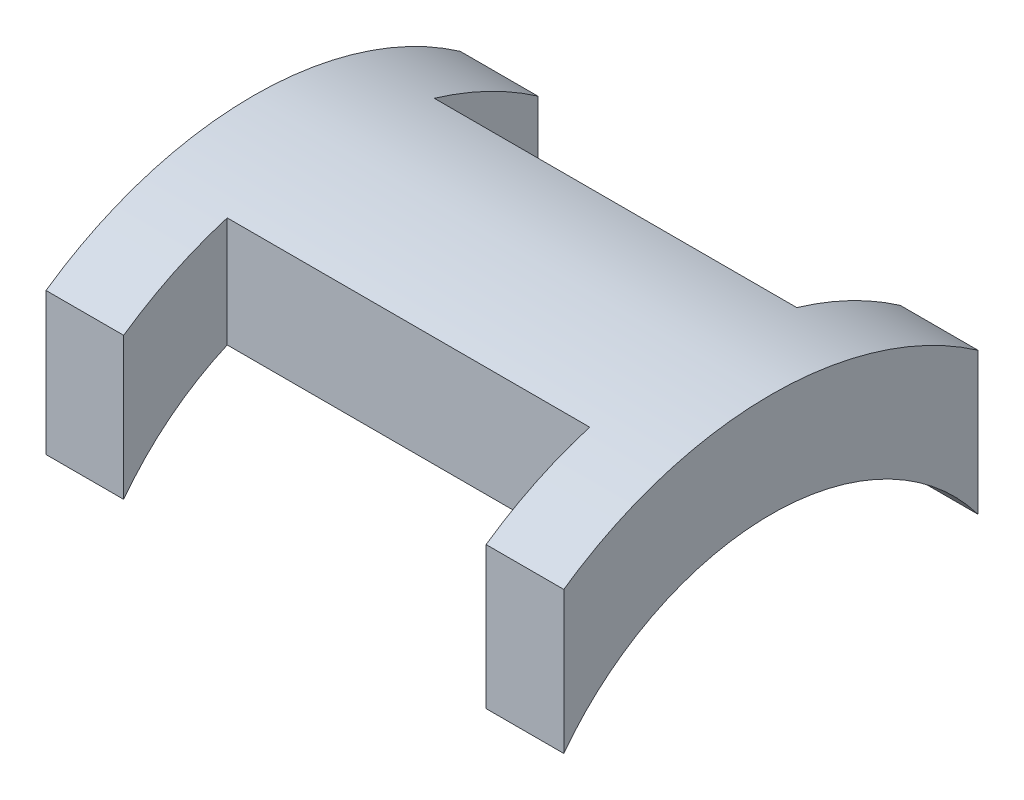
SolidWorks part; units mm, degrees
ref_plane "前视基准面" through (0, 0, 0) normal (0, 0, 1) x (1, 0, 0)
ref_plane "上视基准面" through (0, 0, 0) normal (0, 1, 0) x (1, 0, 0)
ref_plane "右视基准面" through (0, 0, 0) normal (1, 0, 0) x (0, 0, -1)
sketch "草图1" plane through (0, 0, 0) normal (1, 0, 0) x (0, 0, -1)
  line L0 (-40, 57.4456) -> (-40, 30)
  line L1 (0, 0) -> (0, -20.0718) construction
  line L2 (40, 57.4456) -> (40, 30)
  arc A0 (40, 57.4456) -> (-40, 57.4456) centre (0, 0) ccw
  arc A1 (40, 30) -> (-40, 30) centre (0, 0) ccw
  dimension "D1" = 140
  dimension "D2" = 100
  dimension "D3" = 40
extrude "拉伸1" add sketch "草图1" along normal blind 100
sketch "草图2" plane through (0, 0, 0) normal (0, 1, 0) x (1, 0, 0)
  line L0 (0, 0) -> (55.7847, 0) construction
  line L1 (100, 40) -> (0, 40) construction
  line L2 (15, 40) -> (85, 40)
  line L3 (15, 40) -> (15, 20)
  line L4 (15, 20) -> (85, 20)
  line L5 (85, 40) -> (85, 20)
  line L6 (100, -40) -> (100, 40) construction
  line L7 (0, 40) -> (0, -40) construction
  line L8 (85, -40) -> (85, -20)
  line L9 (15, -20) -> (85, -20)
  line L10 (15, -40) -> (15, -20)
  line L11 (15, -40) -> (85, -40)
  dimension "D1" = 15
  dimension "D2" = 15
  dimension "D3" = 20
extrude "切除-拉伸2" cut sketch "草图2" along normal through all
